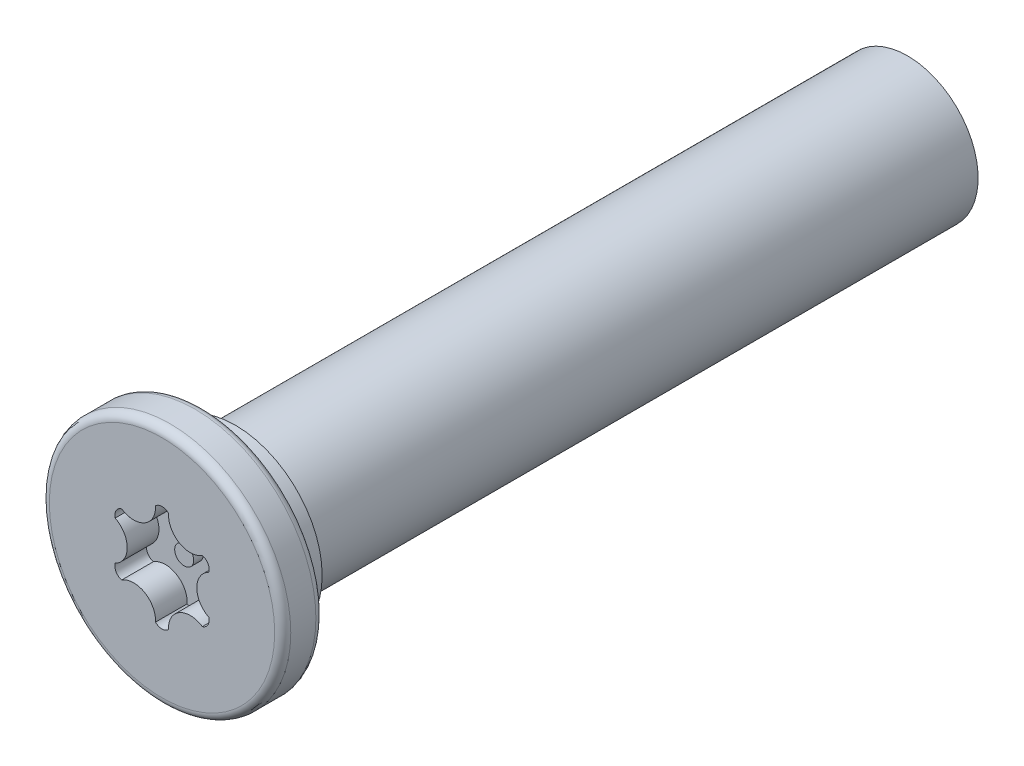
SolidWorks part; units mm, degrees
ref_plane "Front Plane" through (0, 0, 0) normal (0, 0, 1) x (1, 0, 0)
ref_plane "Top Plane" through (0, 0, 0) normal (0, 1, 0) x (1, 0, 0)
ref_plane "Right Plane" through (0, 0, 0) normal (1, 0, 0) x (0, 0, -1)
sketch "Sketch2" plane through (0, 0, 0) normal (1, 0, 0) x (0, 0, -1)
  line L1 (0, 0) -> (1.3, 0)
  line L2 (0, 0) -> (0, 3.81)
  line L3 (0, 3.81) -> (1.3, 3.81)
  line L4 (1.3, 0) -> (1.3, 3.81)
  line L5 (1.3, 0) -> (14, 0)
  line L6 (1.3, 0) -> (1.3, 2.23)
  line L7 (1.3, 2.23) -> (14, 2.23)
  line L8 (14, 0) -> (14, 2.23)
  dimension "D1" = 3.81
  dimension "D2" = 1.3
  dimension "D3" = 12.7
  dimension "D4" = 2.23
revolve "Revolve1" add sketch "Sketch2" angle 360 about L5
sketch "Sketch3" plane through (0, 0, 0) normal (0, 0, 1) x (1, 0, 0)
  line L0 (0, 1.3843) -> (0, 0)
  line L3 (1.1845, -1.0048) -> (2.4257, -1.0048)
  line L4 (0, 1.675) -> (0, 1.6727)
  line L5 (0, 1.675) -> (0, 1.6727)
  line L6 (0, 1.6727) -> (0, 1.675)
  line L8 (1.0407, 1.8026) -> (1.1012, 1.9073)
  line L9 (1.3857, 1.205) -> (2.5818, 1.205)
  line L10 (0, 0) -> (0.8375, 1.4506)
  line L11 (0, 0) -> (2.5818, 0)
  line L14 (2.5818, 0) -> (2.5818, 1.205)
  line L15 (1.3857, 1.205) -> (-0.1691, 1.205)
  circle A0 centre (0, 0) radius 1.675
  arc A7 (1.1845, -1.0048) -> (1.0345, -1.0748) centre (0.8546, -0.4934) cw
  arc A16 (-0.2051, 1.5894) -> (0.2051, 1.5894) centre (0, 1.3843) cw
  arc A18 (0.2051, 1.5894) -> (1.2739, 0.9723) centre (0.8938, 1.5482) ccw
  arc A19 (1.479, 0.6171) -> (1.479, -0.6171) centre (1.7877, 0) ccw
  arc A20 (1.2739, 0.9723) -> (1.479, 0.6171) centre (1.1988, 0.6922) cw
  arc A21 (1.2739, -0.9723) -> (0.2051, -1.5894) centre (0.8938, -1.5482) ccw
  arc A22 (1.479, -0.6171) -> (1.2739, -0.9723) centre (1.1988, -0.6922) cw
  arc A23 (-0.2051, -1.5894) -> (-1.2739, -0.9723) centre (-0.8938, -1.5482) ccw
  arc A24 (0.2051, -1.5894) -> (-0.2051, -1.5894) centre (0, -1.3843) cw
  arc A25 (-1.479, -0.6171) -> (-1.479, 0.6171) centre (-1.7877, 0) ccw
  arc A26 (-1.2739, -0.9723) -> (-1.479, -0.6171) centre (-1.1988, -0.6922) cw
  arc A27 (-1.2739, 0.9723) -> (-0.2051, 1.5894) centre (-0.8938, 1.5482) ccw
  arc A28 (-1.479, 0.6171) -> (-1.2739, 0.9723) centre (-1.1988, 0.6922) cw
  point P38 (0, 0)
  point P52 (0, 0)
  dimension "D1" = 3.35
  dimension "D4" = 1.205
  dimension "D2" = 6
  dimension "D5" = 60
extrude "Cut-Extrude3" cut sketch "Sketch3" against normal blind 1
fillet "Fillet12" radius 0.254 2 edges at (3.81, 0, 0) (3.81, 0, -1.3)
sketch "Sketch7" plane through (0, 0, -14) normal (0, 0, -1) x (-1, 0, 0)
  circle A0 centre (0, 0) radius 2.23
  dimension "D1" = 4.46
extrude "Cut-Extrude6" cut sketch "Sketch7" against normal blind 12.7
sketch "Sketch11" plane through (0, 0, -1.3) normal (0, 0, -1) x (-1, 0, 0)
  circle A0 centre (0, 0) radius 2.23
  circle A1 centre (0, 0) radius 2.738
extrude "Boss-Extrude1" add sketch "Sketch11" along normal blind 1.016
sketch "Sketch12" plane through (0, 0, -1.3) normal (0, 0, -1) x (-1, 0, 0)
  circle A0 centre (0, 0) radius 2.23
extrude "Boss-Extrude2" add sketch "Sketch12" along normal blind 12.7
sketch "Sketch14" plane through (0, 0, -1) normal (0, 0, 1) x (1, 0, 0)
  circle A0 centre (0, 0) radius 0.3
extrude "Boss-Extrude4" add sketch "Sketch14" along normal blind 0.3
sketch "Sketch15" plane through (0, 0, -14) normal (0, 0, -1) x (-1, 0, 0)
  circle A0 centre (0, 0) radius 2.23
extrude "Cut-Extrude7" cut sketch "Sketch15" against normal blind 12.7
sketch "Sketch16" plane through (0, 0, -1.3) normal (0, 0, -1) x (-1, 0, 0)
  circle A0 centre (0, 0) radius 2.23
extrude "Boss-Extrude5" add sketch "Sketch16" along normal blind 22.225
